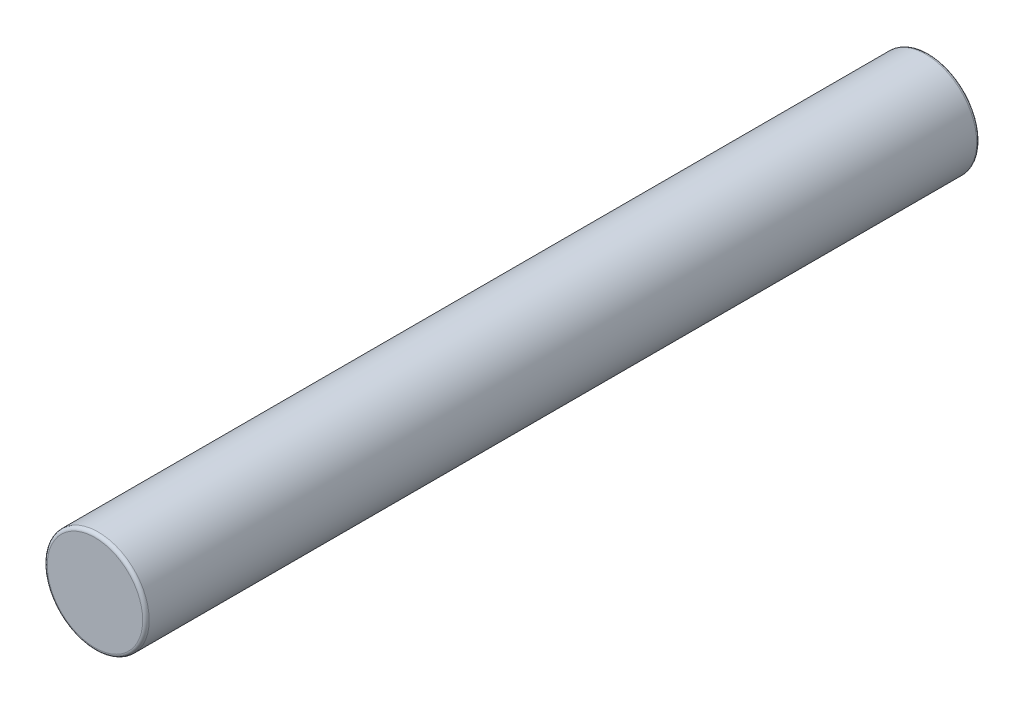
SolidWorks part; units mm, degrees
ref_plane "Front Plane" through (0, 0, 0) normal (0, 0, 1) x (1, 0, 0)
ref_plane "Top Plane" through (0, 0, 0) normal (0, 1, 0) x (1, 0, 0)
ref_plane "Right Plane" through (0, 0, 0) normal (1, 0, 0) x (0, 0, -1)
sketch "Sketch1" plane through (0, 0, 0) normal (0, 0, 1) x (1, 0, 0)
  circle A0 centre (0, 0) radius 1.9844
  dimension "D1" = 3.9688
extrude "Extrude1" add sketch "Sketch1" along normal mid plane 32.4612
fillet "Fillet1" radius 0.127 2 edges at (1.9844, 0, 16.2306) (1.9844, 0, -16.2306)
